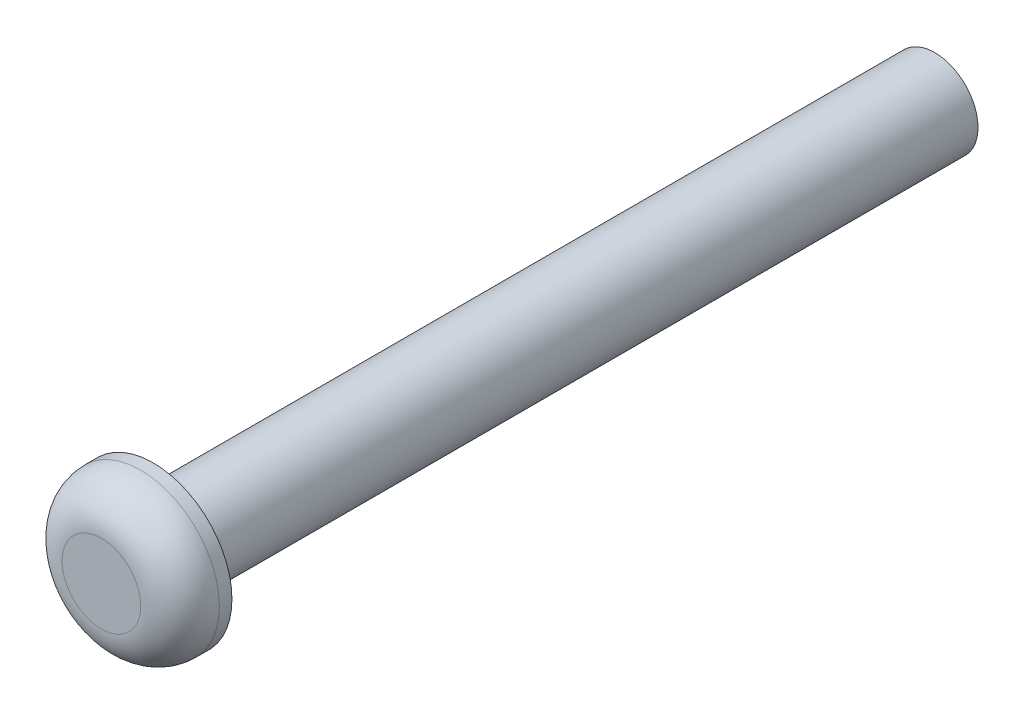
SolidWorks part; units mm, degrees
ref_plane "Front Plane" through (0, 0, 0) normal (0, 0, 1) x (1, 0, 0)
ref_plane "Top Plane" through (0, 0, 0) normal (0, 1, 0) x (1, 0, 0)
ref_plane "Right Plane" through (0, 0, 0) normal (1, 0, 0) x (0, 0, -1)
sketch "Sketch1" plane through (0, 0, 0) normal (0, 0, 1) x (1, 0, 0)
  circle A0 centre (0, 0) radius 2.54
  dimension "D1" = 5.08
extrude "Boss-Extrude1" add sketch "Sketch1" along normal blind 1.6764
sketch "Sketch3" plane through (0, 0, 1.6764) normal (0, 0, 1) x (1, 0, 0)
  circle A0 centre (0, 0) radius 1.397
  dimension "D1" = 2.794
extrude "Boss-Extrude2" add sketch "Sketch3" against normal blind 26.924
fillet "Fillet1" radius 1.27 1 edges at (2.54, 0, 1.6764)
